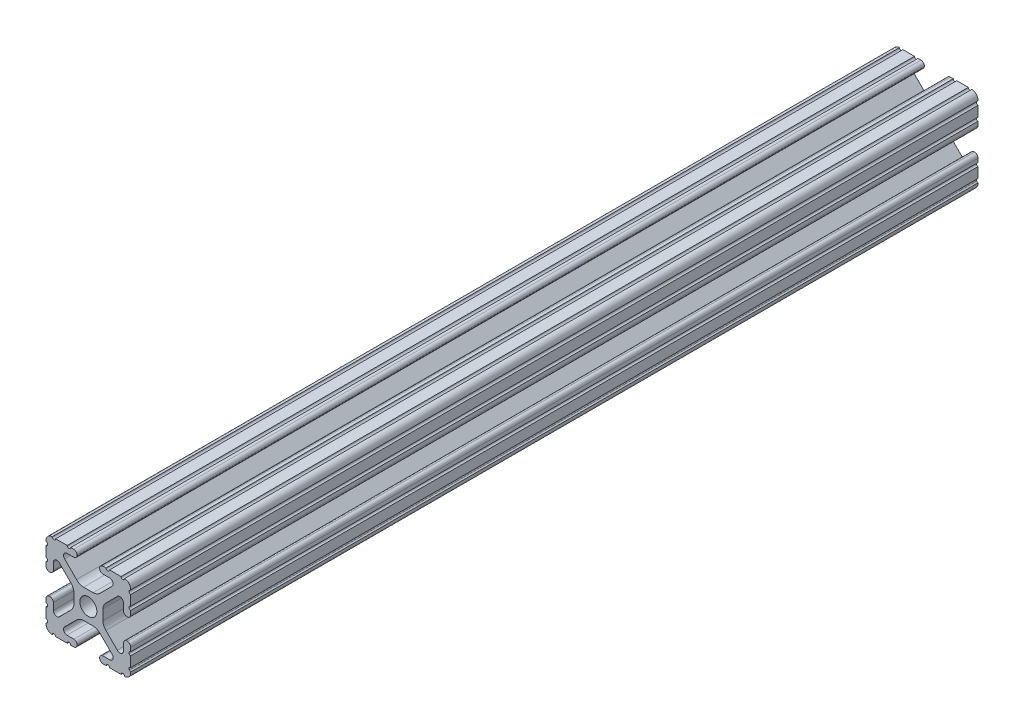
SolidWorks part; units mm, degrees
ref_plane "TRANSVERSE" through (0, 0, 0) normal (0, 0, 1) x (1, 0, 0)
ref_plane "LOWER" through (0, 0, 0) normal (0, 1, 0) x (1, 0, 0)
ref_plane "SIDE" through (0, 0, 0) normal (1, 0, 0) x (0, 0, -1)
sketch "Sketch1" plane through (0, 0, 0) normal (0, 0, 1) x (1, 0, 0)
  line L0 (0, 0) -> (12.7, 12.7) construction
  line L1 (17.0383, 2.0779) -> (19.0969, 2.0779)
  line L2 (16.0603, 1.1542) -> (16.0626, 1.0538)
  line L3 (17.0998, 0.0284) -> (17.9977, 0.0112)
  line L4 (6.3647, 0) -> (2.8953, 0)
  line L5 (23.2003, 8.5089) -> (23.2003, 6.4504)
  line L6 (24.4051, 9.534) -> (24.3048, 9.5393)
  line L7 (0.0099, 2.0494) -> (0.3785, 2.3279)
  line L8 (25.4, 7.3283) -> (25.4, 8.4673)
  line L9 (0, 3.2016) -> (0, 6.2906)
  line L10 (17.9518, 9.1521) -> (21.384, 5.7198)
  line L11 (19.7875, 3.9086) -> (16.2487, 7.4475)
  line L12 (17.0253, 14.2332) -> (17.0253, 11.1668)
  line L13 (25.4, 3.2016) -> (25.4, 6.2906)
  line L14 (25.3901, 2.0494) -> (25.0215, 2.3279)
  line L15 (19.0353, 0) -> (22.5047, 0)
  line L16 (8.3617, 23.3221) -> (6.3031, 23.3221)
  line L17 (9.3397, 24.2458) -> (9.3374, 24.3462)
  line L18 (8.3002, 25.3716) -> (7.4023, 25.3888)
  line L19 (2.1997, 16.8911) -> (2.1997, 18.9496)
  line L20 (0.9949, 15.866) -> (1.0952, 15.8607)
  line L21 (0, 18.0717) -> (0, 16.9327)
  line L22 (7.4482, 16.2479) -> (4.016, 19.6802)
  line L23 (14.1349, 17.0253) -> (11.2651, 17.0253)
  line L24 (5.6125, 21.4914) -> (9.1513, 17.9525)
  line L25 (19.0353, 25.4) -> (22.5047, 25.4)
  line L26 (25.3901, 23.3506) -> (25.0215, 23.0721)
  line L27 (25.4, 22.1984) -> (25.4, 19.1094)
  line L28 (19.7875, 21.4914) -> (16.2487, 17.9525)
  line L29 (17.9518, 16.2479) -> (21.384, 19.6802)
  line L30 (8.3747, 14.2332) -> (8.3747, 11.1668)
  line L31 (0, 22.1984) -> (0, 19.1094)
  line L32 (25.4, 18.0717) -> (25.4, 16.9327)
  line L33 (5.6125, 3.9086) -> (9.1513, 7.4475)
  line L34 (14.1349, 8.3747) -> (11.2651, 8.3747)
  line L35 (0.0099, 23.3506) -> (0.3785, 23.0721)
  line L36 (24.4051, 15.866) -> (24.3048, 15.8607)
  line L37 (23.2003, 16.8911) -> (23.2003, 18.9496)
  line L38 (7.4482, 9.1521) -> (4.016, 5.7198)
  line L39 (6.3647, 25.4) -> (2.8953, 25.4)
  line L40 (17.0998, 25.3716) -> (17.9977, 25.3888)
  line L41 (16.0603, 24.2458) -> (16.0626, 24.3462)
  line L42 (17.0383, 23.3221) -> (19.0969, 23.3221)
  line L46 (0, 7.3283) -> (0, 8.4673)
  line L47 (0.9949, 9.534) -> (1.0952, 9.5393)
  line L48 (2.1997, 8.5089) -> (2.1997, 6.4504)
  line L49 (8.3002, 0.0284) -> (7.4023, 0.0112)
  line L50 (9.3397, 1.1542) -> (9.3374, 1.0538)
  line L51 (8.3617, 2.0779) -> (6.3031, 2.0779)
  line L64 (12.7, 12.7) -> (-5.7969, 12.7) construction
  line L65 (12.7, 12.7) -> (12.7, 0.1656) construction
  line L66 (0, 0) -> (0, 30.1075) construction
  line L67 (0, 0) -> (29.3584, 0) construction
  arc A0 (16.0603, 1.1542) -> (17.0383, 2.0779) centre (17.1028, 1.0301) cw
  arc A1 (17.0998, 0.0284) -> (16.0626, 1.0538) centre (17.1122, 1.0782) cw
  arc A2 (23.2003, 8.5089) -> (24.3048, 9.5393) centre (24.25, 8.4908) cw
  arc A3 (24.4051, 9.534) -> (25.4, 8.4673) centre (24.3503, 8.4855) cw
  arc A4 (7.4023, 0.0112) -> (6.3647, 0) centre (6.8835, 0) ccw
  arc A5 (2.8953, 0) -> (1.8575, 0) centre (2.3764, 0) ccw
  arc A6 (0.0099, 2.0494) -> (1.8575, 0) centre (1.8575, 1.8575) ccw
  arc A7 (0.3785, 2.3279) -> (0, 3.2016) centre (0, 2.6827) ccw
  arc A8 (0, 6.2906) -> (0, 7.3283) centre (0, 6.8094) ccw
  arc A9 (19.7875, 3.9086) -> (19.0969, 2.0779) centre (19.0891, 3.1265) cw
  arc A10 (23.2003, 6.4504) -> (21.384, 5.7198) centre (22.1518, 6.4342) cw
  arc A11 (14.1349, 8.3747) -> (16.2487, 7.4475) centre (14.0036, 5.2024) cw
  arc A12 (17.9518, 9.1521) -> (17.0253, 11.1668) centre (20.2111, 11.4115) cw
  arc A13 (25.4, 6.2906) -> (25.4, 7.3283) centre (25.4, 6.8094) cw
  arc A14 (25.0215, 2.3279) -> (25.4, 3.2016) centre (25.4, 2.6827) cw
  arc A15 (25.3901, 2.0494) -> (23.5425, 0) centre (23.5425, 1.8575) cw
  arc A16 (22.5047, 0) -> (23.5425, 0) centre (23.0236, 0) cw
  arc A17 (17.9977, 0.0112) -> (19.0353, 0) centre (18.5165, 0) cw
  arc A18 (9.3397, 24.2458) -> (8.3617, 23.3221) centre (8.2972, 24.3699) cw
  arc A19 (8.3002, 25.3716) -> (9.3374, 24.3462) centre (8.2878, 24.3218) cw
  circle A20 centre (12.7, 12.7) radius 2.5527
  arc A21 (2.1997, 16.8911) -> (1.0952, 15.8607) centre (1.15, 16.9092) cw
  arc A22 (0.9949, 15.866) -> (0, 16.9327) centre (1.0497, 16.9145) cw
  arc A23 (5.6125, 21.4914) -> (6.3031, 23.3221) centre (6.3109, 22.2735) cw
  arc A24 (2.1997, 18.9496) -> (4.016, 19.6802) centre (3.2482, 18.9658) cw
  arc A25 (11.2651, 17.0253) -> (9.1513, 17.9525) centre (11.3964, 20.1976) cw
  arc A26 (7.4482, 9.1521) -> (8.3747, 11.1668) centre (5.1889, 11.4115) ccw
  arc A27 (11.2651, 8.3747) -> (9.1513, 7.4475) centre (11.3964, 5.2024) ccw
  arc A28 (7.4482, 16.2479) -> (8.3747, 14.2332) centre (5.1889, 13.9885) cw
  arc A29 (17.9977, 25.3888) -> (19.0353, 25.4) centre (18.5165, 25.4) ccw
  arc A30 (2.1997, 6.4504) -> (4.016, 5.7198) centre (3.2482, 6.4342) ccw
  arc A31 (5.6125, 3.9086) -> (6.3031, 2.0779) centre (6.3109, 3.1265) ccw
  arc A32 (22.5047, 25.4) -> (23.5425, 25.4) centre (23.0236, 25.4) ccw
  arc A33 (25.3901, 23.3506) -> (23.5425, 25.4) centre (23.5425, 23.5425) ccw
  arc A34 (25.0215, 23.0721) -> (25.4, 22.1984) centre (25.4, 22.7173) ccw
  arc A35 (25.4, 19.1094) -> (25.4, 18.0717) centre (25.4, 18.5906) ccw
  arc A36 (17.9518, 16.2479) -> (17.0253, 14.2332) centre (20.2111, 13.9885) ccw
  arc A37 (14.1349, 17.0253) -> (16.2487, 17.9525) centre (14.0036, 20.1976) ccw
  arc A38 (23.2003, 18.9496) -> (21.384, 19.6802) centre (22.1518, 18.9658) ccw
  arc A39 (19.7875, 21.4914) -> (19.0969, 23.3221) centre (19.0891, 22.2735) ccw
  arc A40 (0, 19.1094) -> (0, 18.0717) centre (0, 18.5906) cw
  arc A41 (0.9949, 9.534) -> (0, 8.4673) centre (1.0497, 8.4855) ccw
  arc A42 (2.1997, 8.5089) -> (1.0952, 9.5393) centre (1.15, 8.4908) ccw
  arc A43 (8.3002, 0.0284) -> (9.3374, 1.0538) centre (8.2878, 1.0782) ccw
  arc A44 (9.3397, 1.1542) -> (8.3617, 2.0779) centre (8.2972, 1.0301) ccw
  arc A45 (0.3785, 23.0721) -> (0, 22.1984) centre (0, 22.7173) cw
  arc A46 (0.0099, 23.3506) -> (1.8575, 25.4) centre (1.8575, 23.5425) cw
  arc A47 (2.8953, 25.4) -> (1.8575, 25.4) centre (2.3764, 25.4) cw
  arc A48 (7.4023, 25.3888) -> (6.3647, 25.4) centre (6.8835, 25.4) cw
  arc A49 (24.4051, 15.866) -> (25.4, 16.9327) centre (24.3503, 16.9145) ccw
  arc A50 (23.2003, 16.8911) -> (24.3048, 15.8607) centre (24.25, 16.9092) ccw
  arc A51 (17.0998, 25.3716) -> (16.0626, 24.3462) centre (17.1122, 24.3218) ccw
  arc A52 (16.0603, 24.2458) -> (17.0383, 23.3221) centre (17.1028, 24.3699) ccw
  point P52 (12.7, 8.3747)
  point P78 (17.0253, 12.7)
  point P157 (12.7, 17.0253)
  point P158 (8.3747, 12.7)
  dimension "D1" = 12.7
  dimension "D2" = 45
extrude "Extrude1" add sketch "Sketch1" along normal blind 254
ref_plane "MID-1" through (12.7, 0, 0) normal (1, 0, 0) x (0, 0, -1)
ref_plane "MID-2" through (0, 12.7, 0) normal (0, 1, 0) x (-1, 0, 0)
